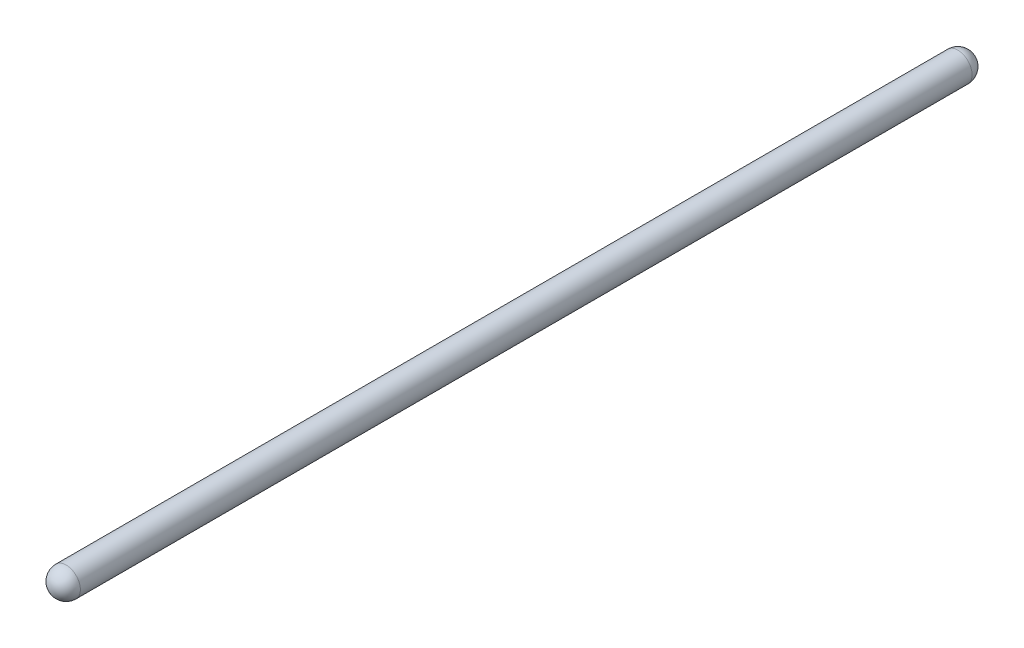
SolidWorks part; units mm, degrees
ref_plane "Plan de face" through (0, 0, 0) normal (0, 0, 1) x (1, 0, 0)
ref_plane "Plan de dessus" through (0, 0, 0) normal (0, 1, 0) x (1, 0, 0)
ref_plane "Plan de droite" through (0, 0, 0) normal (1, 0, 0) x (0, 0, -1)
sketch "Esquisse1" plane through (0, 0, 0) normal (0, 0, 1) x (1, 0, 0)
  circle A0 centre (0, 0) radius 1
  dimension "D1" = 2
extrude "Boss.-Extru.1" add sketch "Esquisse1" along normal blind 64.5
fillet "Congé1" radius 1 2 edges at (1, 0, 0) (1, 0, 64.5)
